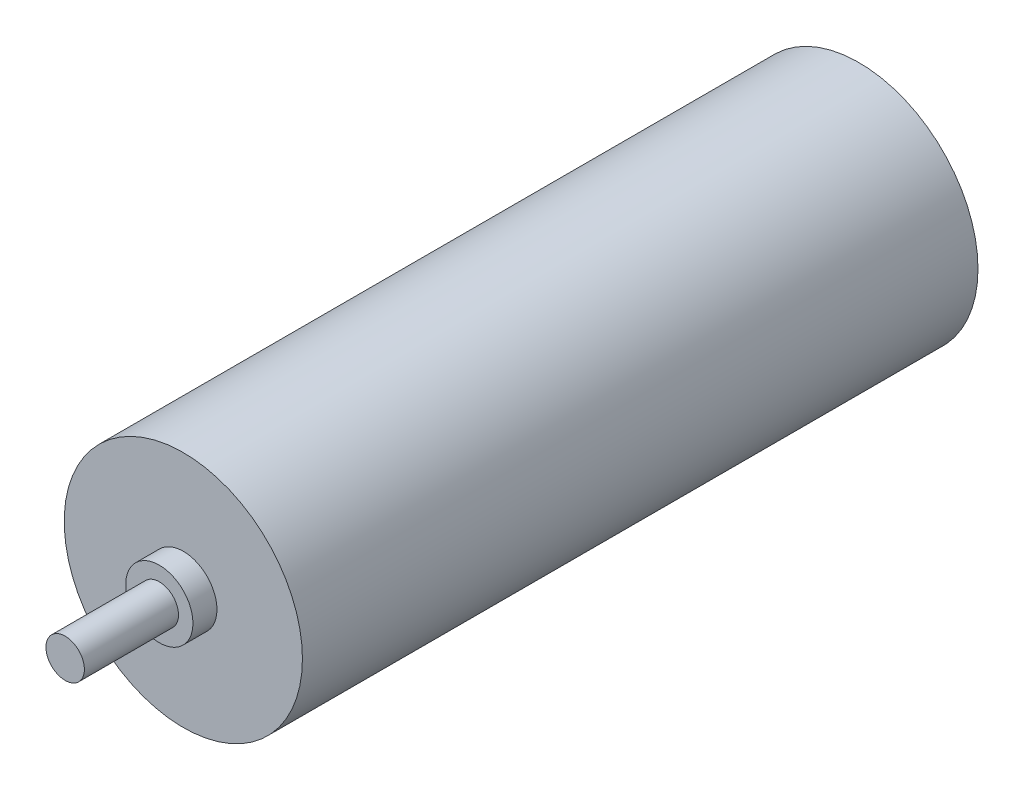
SolidWorks part; units mm, degrees
ref_plane "Plan de face" through (0, 0, 0) normal (0, 0, 1) x (1, 0, 0)
ref_plane "Plan de dessus" through (0, 0, 0) normal (0, 1, 0) x (1, 0, 0)
ref_plane "Plan de droite" through (0, 0, 0) normal (1, 0, 0) x (0, 0, -1)
sketch "Esquisse1" plane through (0, 0, 0) normal (0, 0, 1) x (1, 0, 0)
  circle A0 centre (0, 0) radius 12.4
  dimension "D1" = 24.8
extrude "Boss.-Extru.1" add sketch "Esquisse1" along normal blind 70.33
sketch "Esquisse2" plane through (0, 0, 70.33) normal (0, 0, 1) x (1, 0, 0)
  circle A0 centre (0, 0) radius 3.5
  dimension "D1" = 7
extrude "Boss.-Extru.2" add sketch "Esquisse2" along normal blind 2.5
sketch "Esquisse3" plane through (0, 0, 72.83) normal (0, 0, 1) x (1, 0, 0)
  circle A0 centre (0, 0) radius 2
  dimension "D1" = 4
extrude "Boss.-Extru.3" add sketch "Esquisse3" along normal blind 9.8
